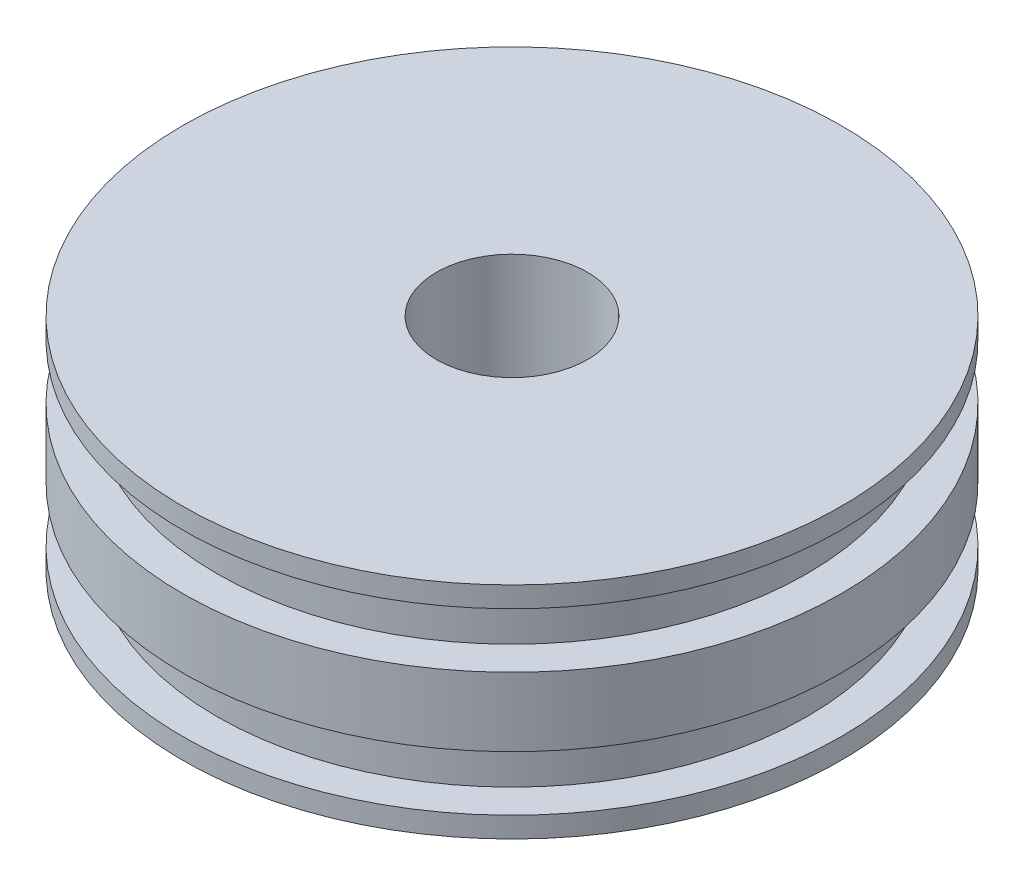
SolidWorks part; units mm, degrees
ref_plane "Front Plane" through (0, 0, 0) normal (0, 0, 1) x (1, 0, 0)
ref_plane "Top Plane" through (0, 0, 0) normal (0, 1, 0) x (1, 0, 0)
ref_plane "Right Plane" through (0, 0, 0) normal (1, 0, 0) x (0, 0, -1)
sketch "Sketch1" plane through (0, 0, 0) normal (0, 0, 1) x (1, 0, 0)
  line L0 (0, 0) -> (38.0365, 0)
  line L9 (38.0365, 0) -> (38.0365, 25.4)
  line L10 (38.0365, 25.4) -> (0, 25.4)
  line L11 (0, 25.4) -> (0, 0)
  line L12 (0, 0) -> (0, -39.3237) construction
  dimension "D1" = 76.073
  dimension "D5" = 25.4
revolve "Revolve1" add sketch "Sketch1" angle 360 about L12
hole_wizard "3/4-16 Tapped Hole1" positions "Sketch3" profile "Sketch2" tap size "3/4-16" standard "Example Inch"
sketch "Sketch3" plane through (0, 25.4, 0) normal (0, 1, 0) x (-1, 0, 0)
  point P0 (0, 0)
sketch "Sketch2" plane through (0, 25.4, 0) normal (1, 0, 0) x (0, 0, 1)
  line L0 (0, 0) -> (0, 25.4)
  line L1 (0, 25.4) -> (8.7312, 25.4)
  line L2 (8.7312, 25.4) -> (8.7312, 0)
  line L5 (8.7312, 0) -> (0, 0)
  line L11 (0, -6.35) -> (0, 107.95) construction
  dimension "Thru Tap Drill Dia." = 17.4625
  dimension "Thru Tap Drill Depth" = 25.4
sketch "Sketch4" plane through (0, 0, 0) normal (0, 0, 1) x (1, 0, 0)
  line L0 (38.0365, 2.3812) -> (34.0678, 2.3812)
  line L1 (38.0365, 0) -> (38.0365, 25.4) construction
  line L2 (34.0678, 2.3812) -> (34.0678, 8.7312)
  line L3 (34.0678, 8.7312) -> (38.0365, 8.7312)
  line L4 (38.0365, 8.7312) -> (38.0365, 2.3812)
  line L5 (-38.0365, 0) -> (38.0365, 0) construction
  dimension "D1" = 2.3813
  dimension "D2" = 6.35
  dimension "D3" = 3.9688
revolve "Cut-Revolve1" cut sketch "Sketch4" angle 360 about axis through (0, 0, 0) along (0, 1, 0)
pattern_linear "LPattern1" count 2 spacing 14.2875 along (0, 1, 0) of "Cut-Revolve1"
